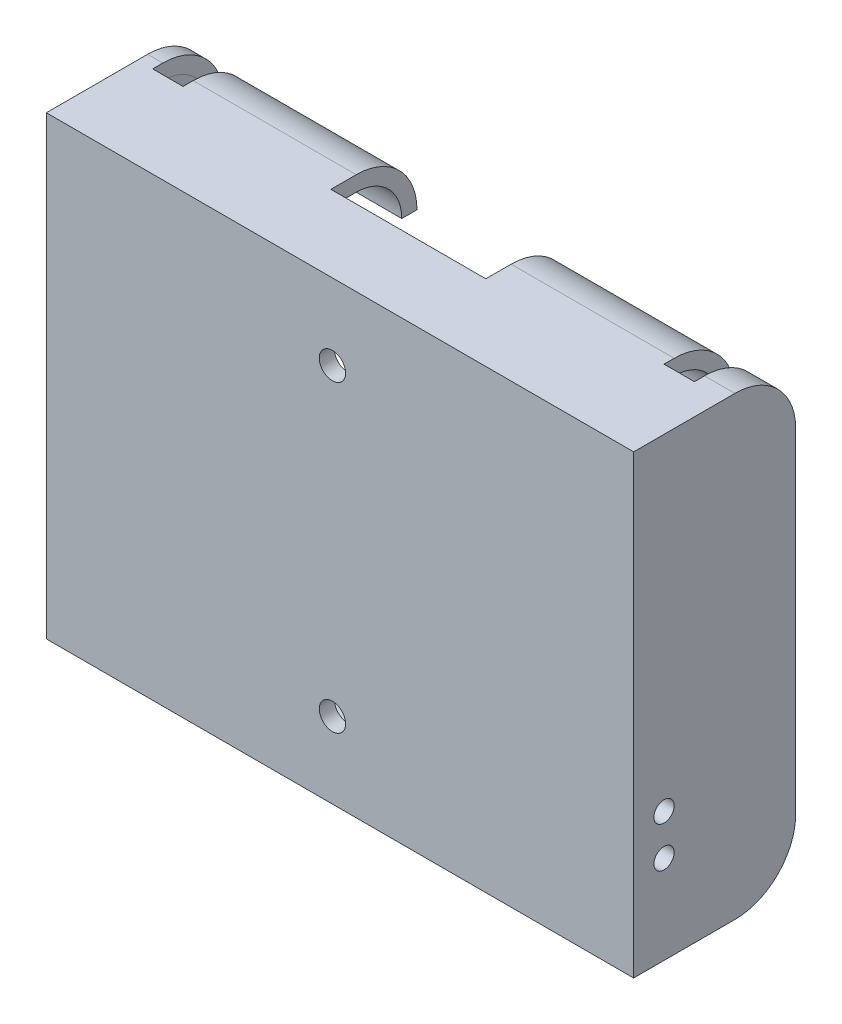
SolidWorks part; units mm, degrees
ref_plane "Face" through (0, 0, 0) normal (0, 0, 1) x (1, 0, 0)
ref_plane "Dessus" through (0, 0, 0) normal (0, 1, 0) x (1, 0, 0)
ref_plane "Droite" through (0, 0, 0) normal (1, 0, 0) x (0, 0, -1)
sketch "Esquisse1" plane through (0, 0, 0) normal (0, 0, 1) x (1, 0, 0)
  line L0 (-28.25, 36.4313) -> (-28.25, -47.0804) construction
  line L1 (29.7456, 41.4313) -> (29.7456, -42.0804) construction
  line L2 (-42.1757, -10.75) -> (43.8582, -10.75) construction
  line L5 (-28.25, 34.25) -> (29.75, 34.25)
  line L6 (-28.25, 34.25) -> (-28.2544, -10.75)
  line L7 (-28.2544, -10.75) -> (29.7456, -10.75)
  line L8 (29.75, 34.25) -> (29.7456, -10.75)
  dimension "D2" = 58
  dimension "D3" = 45
extrude "Base-Extrusion" add sketch "Esquisse1" against normal blind 16
fillet "Congé1" radius 6 2 edges at (0.75, 34.25, -16) (0.7456, -10.75, -16)
shell "Coque1" thickness 1.5
sketch "Esquisse3" plane through (0, 34.25, 0) normal (0, 1, 0) x (-1, 0, 0)
  line L0 (29.248, -9) -> (-31.6408, -9) construction
  line L1 (26.75, -2.27) -> (26.75, -22.4823) construction
  line L2 (-26.75, -2.27) -> (-26.75, -20.7193) construction
  line L3 (12.4989, -7.5) -> (-13.5693, -7.5) construction
  line L4 (0, -0.5699) -> (0, -21.8527) construction
  line L5 (23.75, -7.5) -> (23.75, -19.2081) construction
  line L6 (7.65, -19.2081) -> (7.65, -4.6628) construction
  line L7 (-7.65, -19.2081) -> (-7.65, -4.159) construction
  line L8 (-26.75, -19.2081) -> (-23.75, -19.2081)
  line L9 (26.75, -9) -> (23.75, -9)
  line L10 (26.75, -9) -> (26.75, -19.2081)
  line L11 (26.75, -19.2081) -> (23.75, -19.2081)
  line L12 (23.75, -9) -> (23.75, -19.2081)
  line L13 (7.65, -7.5) -> (-7.65, -7.5)
  line L14 (7.65, -7.5) -> (7.65, -18.3265)
  line L15 (7.65, -18.3265) -> (-7.65, -18.3265)
  line L16 (-7.65, -7.5) -> (-7.65, -18.3265)
  line L17 (-26.75, -9) -> (-26.75, -19.2081)
  line L18 (-26.75, -9) -> (-23.75, -9)
  line L19 (-23.75, -9) -> (-23.75, -19.2081)
extrude "Enlèv. mat.-Extru.2" cut sketch "Esquisse3" against normal through all
sketch "Esquisse4" plane through (29.7466, -0.0029, 0) normal (1, -0.0001, 0) x (0, 0, -1)
  line L0 (-1.5631, 0) -> (18.4717, 0) construction
  line L1 (-1.5631, -2) -> (17.0634, -2) construction
  line L2 (-1.5631, 2) -> (19.7892, 2) construction
  line L3 (3, 3.8616) -> (3, -2.9984) construction
  circle A0 centre (3, 2) radius 1
  circle A1 centre (3, -2) radius 1
extrude "Enlèv. mat.-Extru.3" cut sketch "Esquisse4" against normal blind 6
sketch "Esquisse5" plane through (-41.166, -21.1238, -1.5) normal (0, 0, -1) x (-1, 0, 0)
  line L0 (-69.4138, 32.8738) -> (0, 32.8738) construction
  line L3 (-41.166, 53.8738) -> (-41.166, 0) construction
  line L4 (-33.516, 53.8738) -> (-48.816, 53.8738) construction
  line L5 (-69.4122, 16.3738) -> (-69.4154, 49.3738) construction
  circle A0 centre (-41.166, 47.8738) radius 1.3
  circle A1 centre (-41.166, 17.8738) radius 1.3
  dimension "D1" = 2.6
  dimension "D2" = 30
  dimension "D3" = 15
extrude "Enlèv. mat.-Extru.4" cut sketch "Esquisse5" against normal through all
